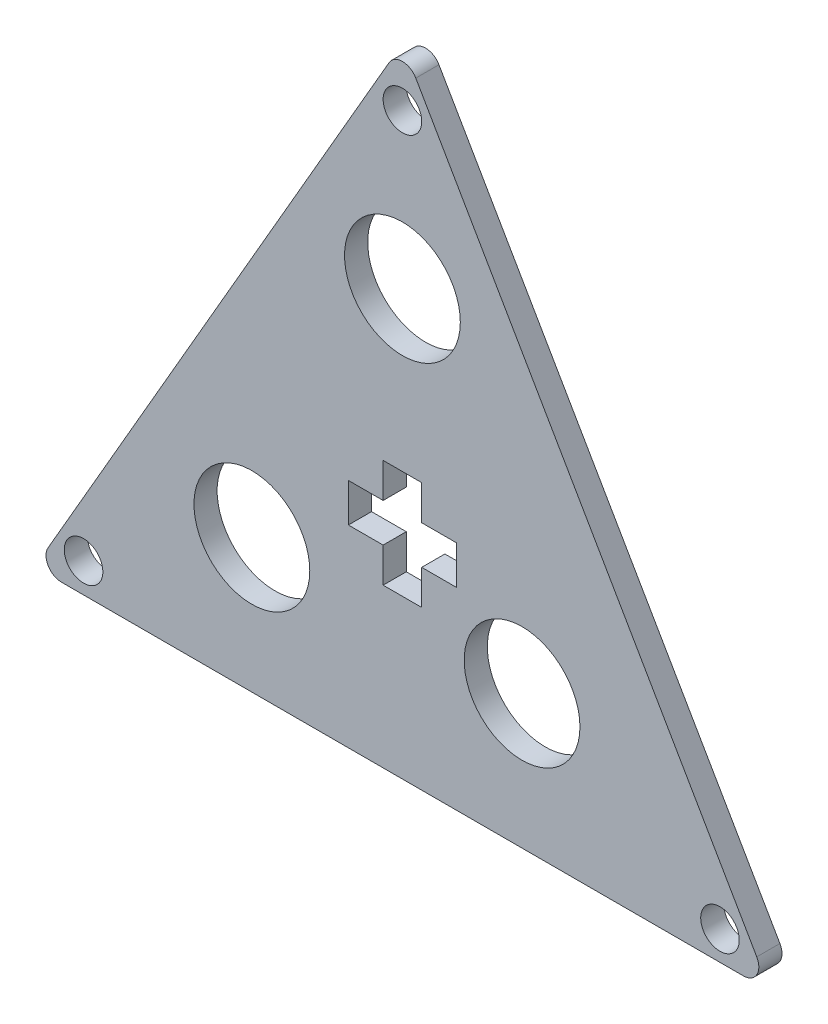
SolidWorks part; units mm, degrees
ref_plane "前视基准面" through (0, 0, 0) normal (0, 0, 1) x (1, 0, 0)
ref_plane "上视基准面" through (0, 0, 0) normal (0, 1, 0) x (1, 0, 0)
ref_plane "右视基准面" through (0, 0, 0) normal (1, 0, 0) x (0, 0, -1)
other "Configuration Table"
sketch "草图1" plane through (0, 0, 0) normal (0, 0, 1) x (1, 0, 0)
  line L0 (0, 55) -> (-47.6314, -27.5)
  line L1 (-47.6314, -27.5) -> (47.6314, -27.5)
  line L2 (47.6314, -27.5) -> (0, 55)
  dimension "D2" = 60
  dimension "D3" = 60
extrude "凸台-拉伸1" add sketch "草图1" along normal blind 3
fillet "圆角1" radius 2 3 edges at (47.6314, -27.5, 1.5) (-47.6314, -27.5, 1.5) (0, 55, 1.5)
sketch "草图2" plane through (0, 0, 3) normal (0, 0, 1) x (1, 0, 0)
  line L0 (-44.1673, -27.5) -> (44.1673, -27.5) construction
  circle A0 centre (0, 27.5) radius 7.5
  circle A1 centre (-19.5024, -10.1489) radius 7.5
  circle A2 centre (15.4976, -10.1489) radius 7.5
  dimension "D1" = 15
  dimension "D2" = 15
  dimension "D3" = 15
  dimension "D4" = 35
  dimension "D5" = 55
extrude "切除-拉伸1" cut sketch "草图2" against normal blind 3 contours A0 | A1 | A2
sketch "草图4" plane through (0, 0, 3) normal (0, 0, 1) x (1, 0, 0)
  line L0 (61.274, -35.6329) -> (-23.8157, 13.75) construction
  line L1 (-1.7321, 52) -> (-45.8993, -24.5) construction
  line L2 (-45.8993, -26.5) -> (23.8157, 13.75) construction
  line L3 (45.8993, -24.5) -> (1.7321, 52) construction
  circle A0 centre (0, 47.5) radius 2.5
  arc A1 (-45.8993, -24.5) -> (-44.1673, -27.5) centre (-44.1673, -25.5) ccw construction
  circle A2 centre (-41.3052, -23.6715) radius 2.5
  circle A3 centre (41.1362, -23.75) radius 2.5
  dimension "D1" = 5
  dimension "D2" = 47.5
extrude "切除-拉伸2" cut sketch "草图4" against normal blind 3
sketch "草图5" plane through (0, 0, 3) normal (0, 0, 1) x (1, 0, 0)
  circle A0 centre (0, 0) radius 1.5
  dimension "D1" = 3
extrude "切除-拉伸3" cut sketch "草图5" against normal blind 10
sketch "草图6" plane through (0, 0, 3) normal (0, 0, 1) x (1, 0, 0)
  line L1 (2.5, -7) -> (-2.5, -7)
  line L2 (2.5, -7) -> (2.5, 7)
  line L3 (2.5, 7) -> (-2.5, 7)
  line L4 (-2.5, -7) -> (-2.5, 7)
  line L5 (2.5, -7) -> (-2.5, 7) construction
  line L6 (2.5, 7) -> (-2.5, -7) construction
  line L7 (7, -2.5) -> (-7, -2.5)
  line L8 (7, -2.5) -> (7, 2.5)
  line L9 (7, 2.5) -> (-7, 2.5)
  line L10 (-7, -2.5) -> (-7, 2.5)
  line L11 (7, -2.5) -> (-7, 2.5) construction
  line L12 (7, 2.5) -> (-7, -2.5) construction
  point P0 (0, 0)
  point P6 (0, 0)
  dimension "D1" = 5
  dimension "D2" = 14
  dimension "D3" = 5
  dimension "D4" = 14
extrude "切除-拉伸4" cut sketch "草图6" against normal through all contours L3 L4 L1 L2 | L9 L10 L7 L8
